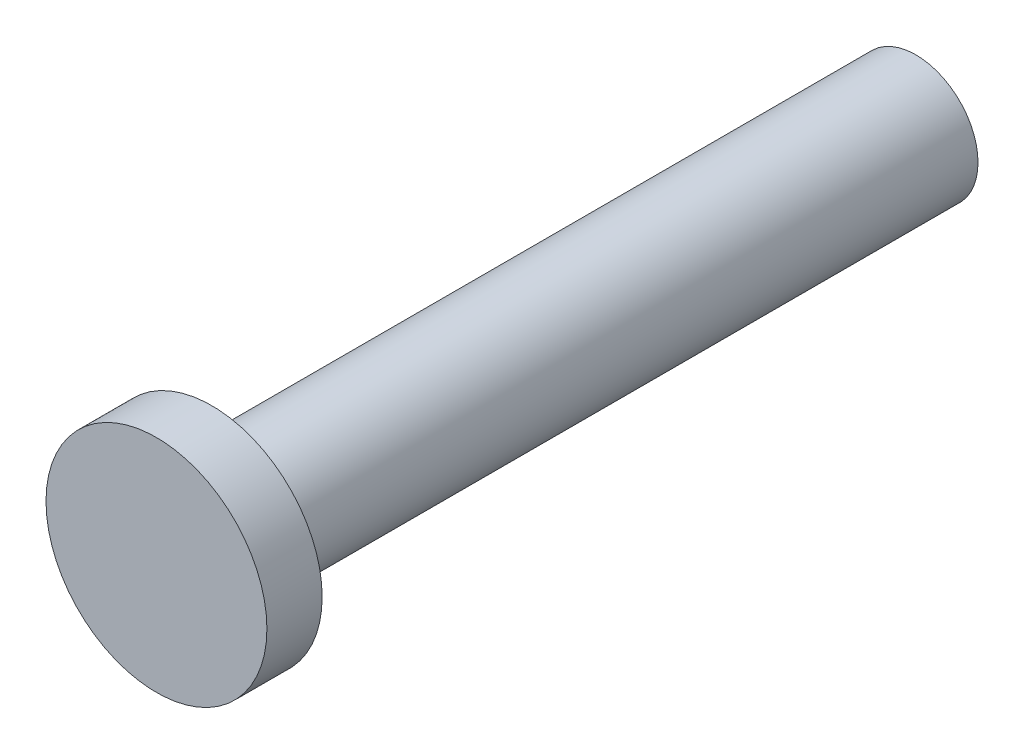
SolidWorks part; units mm, degrees
ref_plane "Plano frontal" through (0, 0, 0) normal (0, 0, 1) x (1, 0, 0)
ref_plane "Plano superior" through (0, 0, 0) normal (0, 1, 0) x (1, 0, 0)
ref_plane "Plano direito" through (0, 0, 0) normal (1, 0, 0) x (0, 0, -1)
sketch "Esboço1" plane through (0, 0, 0) normal (0, 0, 1) x (1, 0, 0)
  circle A0 centre (0, 0) radius 4.5
  dimension "D1" = 9
extrude "Ressalto-extrusão1" add sketch "Esboço1" along normal blind 51
sketch "Esboço2" plane through (0, 0, 51) normal (0, 0, 1) x (1, 0, 0)
  circle A0 centre (0, 0) radius 8
  dimension "D1" = 16
extrude "Ressalto-extrusão2" add sketch "Esboço2" along normal blind 4
hole_wizard "Furo roscado de M51" positions "Esboço3" profile "Esboço4" tap size "M5" standard "ISO"
sketch "Esboço3" plane through (0, 0, 0) normal (0, 0, -1) x (-1, 0, 0)
  point P0 (0, 0)
sketch "Esboço4" plane through (0, 0, 0) normal (1, 0, 0) x (0, 1, 0)
  line L0 (0, 0) -> (0, 15.2618)
  line L1 (0, 15.2618) -> (2.1, 14)
  line L2 (2.1, 14) -> (2.1, 0)
  line L5 (2.1, 0) -> (0, 0)
  line L10 (0, 15.2618) -> (-2.1, 14) construction
  line L11 (0, -6.35) -> (0, 107.95) construction
  dimension "Tap Drill Dia." = 4.2
  dimension "Tap Drill Depth" = 14
  dimension "Drill Angle" = 118
sketch "Esboço5" plane through (0, 0, 0) normal (0, 0, -1) x (-1, 0, 0)
  line L0 (-4.5, 0) -> (4.5, 0) construction
  circle A0 centre (0, 0) radius 4.5 construction
  point P0 (0, 0)
